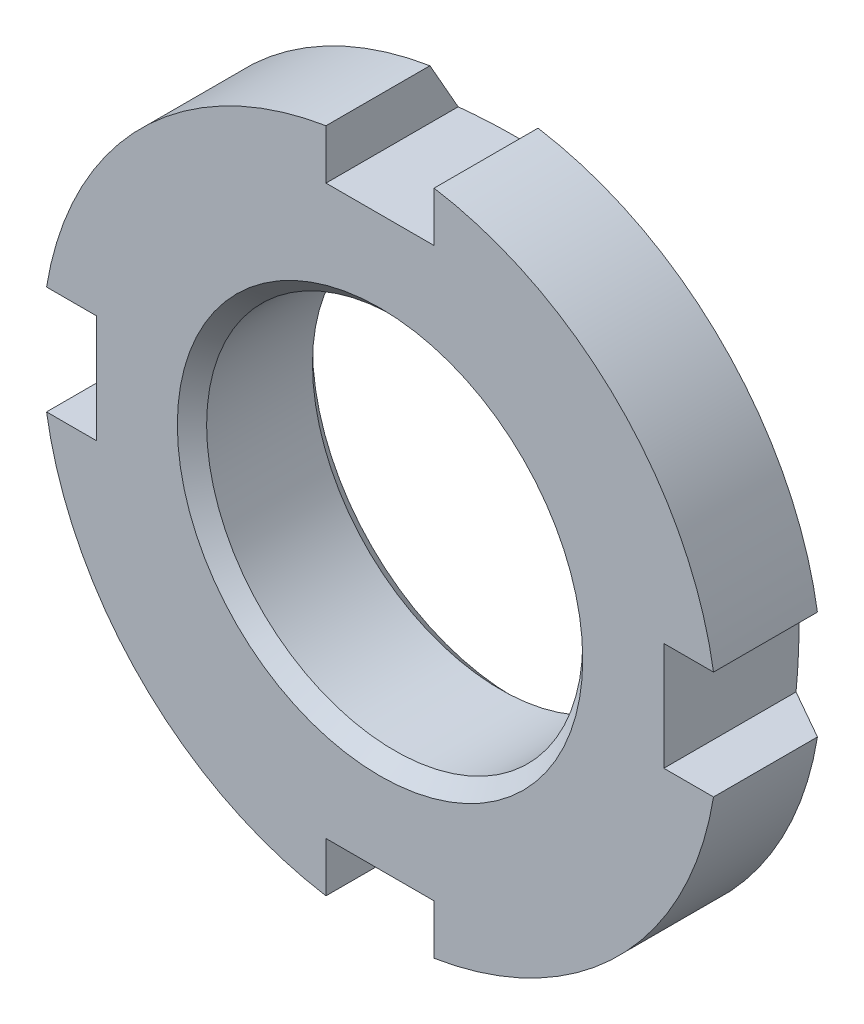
SolidWorks part; units mm, degrees
ref_plane "Front X-Y" through (0, 0, 0) normal (0, 0, 1) x (1, 0, 0)
ref_plane "Top X-Z" through (0, 0, 0) normal (0, 1, 0) x (1, 0, 0)
ref_plane "Right Y-Z" through (0, 0, 0) normal (1, 0, 0) x (0, 0, -1)
ref_plane "Plane1" through (0, 0, 0) normal (1, 0, 0) x (0, 0, -1)
sketch "Sketch1" plane through (0, 0, 0) normal (1, 0, 0) x (0, 0, -1)
  line L0 (0, 12.5) -> (0, 7.5)
  line L1 (0, 7.5) -> (0.5415, 6.9585)
  line L2 (0.5415, 6.9585) -> (4.4585, 6.9585)
  line L3 (4.4585, 6.9585) -> (5, 7.5)
  line L4 (5, 7.5) -> (5, 10.5)
  line L5 (5, 10.5) -> (3.8453, 12.5)
  line L6 (3.8453, 12.5) -> (0, 12.5)
  line L7 (5, 0) -> (0, 0) construction
revolve "Revolve1" add sketch "Sketch1" angle 360 about L7
ref_plane "Plane2" through (0, 0, 0) normal (0, 0, 1) x (1, 0, 0)
sketch "Sketch2" plane through (0, 0, 0) normal (0, 0, 1) x (1, 0, 0)
  line L0 (-19.1265, 2) -> (-10.5, 2)
  line L1 (-10.5, 2) -> (-10.5, -2)
  line L2 (-10.5, -2) -> (-19.1265, -2)
  line L3 (-2, -19.1265) -> (-2, -10.5)
  line L4 (-2, -10.5) -> (2, -10.5)
  line L5 (2, -10.5) -> (2, -19.1265)
  line L6 (19.1265, -2) -> (10.5, -2)
  line L7 (10.5, -2) -> (10.5, 2)
  line L8 (10.5, 2) -> (19.1265, 2)
  line L9 (2, 19.1265) -> (2, 10.5)
  line L10 (2, 10.5) -> (-2, 10.5)
  line L11 (-2, 10.5) -> (-2, 19.1265)
  circle A0 centre (0, 0) radius 25
  arc A1 (-19.1265, -2) -> (-2, -19.1265) centre (0, 0) ccw
  arc A2 (2, -19.1265) -> (19.1265, -2) centre (0, 0) ccw
  arc A3 (19.1265, 2) -> (2, 19.1265) centre (0, 0) ccw
  arc A4 (-2, 19.1265) -> (-19.1265, 2) centre (0, 0) ccw
extrude "Cut-Extrude1" cut sketch "Sketch2" against normal blind 5
